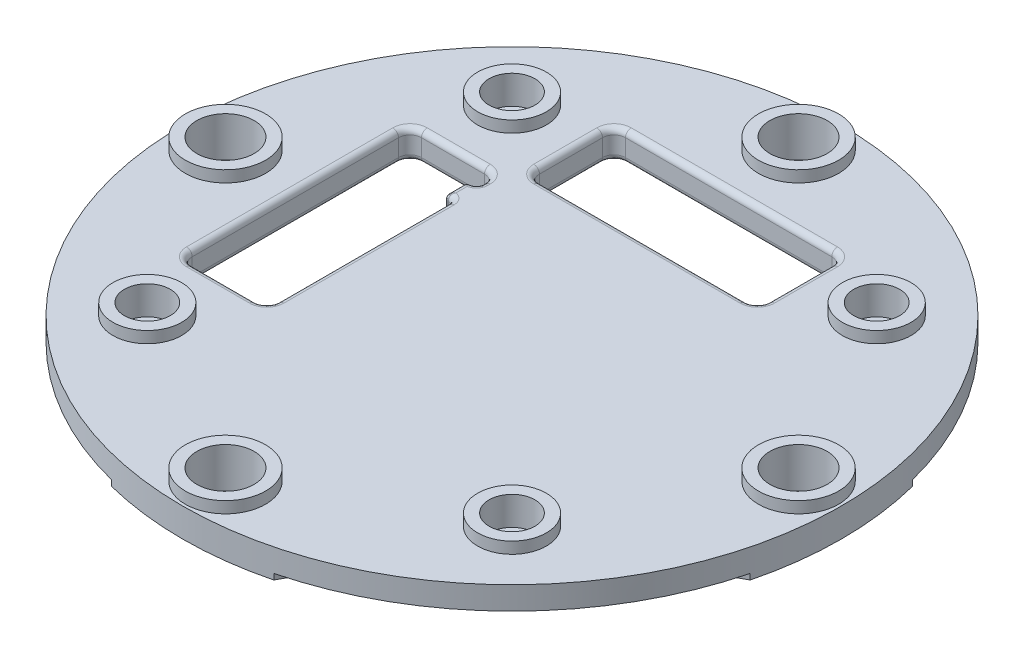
SolidWorks part; units mm, degrees
ref_plane "Front Plane" through (0, 0, 0) normal (0, 0, 1) x (1, 0, 0)
ref_plane "Top Plane" through (0, 0, 0) normal (0, 1, 0) x (1, 0, 0)
ref_plane "Right Plane" through (0, 0, 0) normal (1, 0, 0) x (0, 0, -1)
sketch "Sketch1" plane through (0, 0, 0) normal (0, 1, 0) x (1, 0, 0)
  circle A0 centre (0, 0) radius 57.5
  circle A1 centre (0, 0) radius 50 construction
  circle A2 centre (0, 50) radius 5
  circle A3 centre (50, 0) radius 5
  circle A4 centre (0, -50) radius 5
  circle A5 centre (-50, 0) radius 5
  point P15 (0, 0)
  dimension "D1" = 100
  dimension "D2" = 115
  dimension "D3" = 10
  dimension "D4" = 4
extrude "Boss-Extrude1" add sketch "Sketch1" along normal blind 5
sketch "Sketch11" plane through (0, 5, 0) normal (0, 1, 0) x (1, 0, 0)
  line L0 (0, 50) -> (0, 0) construction
  line L1 (0, 0) -> (-31.8198, 31.8198) construction
  circle A2 centre (0, 0) radius 45 construction
  circle A5 centre (-31.8198, 31.8198) radius 6
  circle A6 centre (31.8198, 31.8198) radius 6
  circle A7 centre (31.8198, -31.8198) radius 6
  circle A8 centre (-31.8198, -31.8198) radius 6
  point P16 (0, 0)
  dimension "D1" = 90
  dimension "D2" = 12
  dimension "D3" = 4
extrude "Boss-Extrude3" add sketch "Sketch11" along normal blind 2
sketch "Sketch12" plane through (0, 7, 0) normal (0, 1, 0) x (1, 0, 0)
  circle A0 centre (-31.8198, 31.8198) radius 4
  circle A1 centre (31.8198, 31.8198) radius 4
  circle A2 centre (31.8198, -31.8198) radius 4
  circle A3 centre (-31.8198, -31.8198) radius 4
  point P12 (0, 0)
  dimension "D1" = 8
  dimension "D2" = 4
extrude "Cut-Extrude9" cut sketch "Sketch12" against normal blind 5
sketch "Sketch13" plane through (0, 5, 0) normal (0, 1, 0) x (1, 0, 0)
  circle A0 centre (0, 50) radius 7
  circle A1 centre (0, 50) radius 5
  circle A2 centre (0, 50) radius 5 construction
  circle A3 centre (50, 0) radius 5
  circle A4 centre (50, 0) radius 7
  circle A5 centre (0, -50) radius 5
  circle A6 centre (0, -50) radius 7
  circle A7 centre (-50, 0) radius 5
  circle A8 centre (-50, 0) radius 7
  point P18 (0, 0)
  dimension "D1" = 2
  dimension "D2" = 4
extrude "Boss-Extrude4" add sketch "Sketch13" along normal blind 2
sketch "Sketch18" plane through (0, 0, 0) normal (0, -1, 0) x (-1, 0, 0)
  line L0 (0, 0) -> (-56.3135, -56.3135) construction
  circle A0 centre (-102.5305, -102.5305) radius 100
  circle A1 centre (-102.5305, 102.5305) radius 100
  circle A2 centre (102.5305, 102.5305) radius 100
  circle A3 centre (102.5305, -102.5305) radius 100
  point P15 (0, 0)
  dimension "D1" = 200
  dimension "D2" = 145
  dimension "D3" = 4
extrude "Cut-Extrude13" cut sketch "Sketch18" against normal blind 1
sketch "Sketch19" plane through (0, 0, 0) normal (0, -1, 0) x (-1, 0, 0)
  line L0 (-7.2, -4) -> (-7.2, 19.1)
  line L1 (19, -3.8) -> (-7, -3.8)
  line L2 (19, -3.8) -> (19, 18.9)
  line L3 (19, 18.9) -> (-7, 18.9)
  line L4 (-7, -3.8) -> (-7, 18.9)
  line L5 (23.25, 13.9) -> (-10.7424, 13.9)
  line L6 (23.25, 13.9) -> (23.25, 15.4)
  line L7 (23.25, 15.4) -> (-10.7424, 15.4)
  line L8 (-10.7424, 13.9) -> (-10.7424, 15.4)
  line L9 (19.2, 19.1) -> (-7.2, 19.1)
  line L10 (19.2, -4) -> (19.2, 19.1)
  line L11 (19.2, -4) -> (-7.2, -4)
  line L12 (23.45, 13.7) -> (23.45, 15.6)
  line L13 (23.45, 15.6) -> (-10.9424, 15.6)
  line L14 (-10.9424, 13.7) -> (-10.9424, 15.6)
  line L15 (23.45, 13.7) -> (-10.9424, 13.7)
  line L16 (-4, 7.2) -> (19.1, 7.2)
  line L17 (13.7, -23.45) -> (13.7, 10.9424)
  line L18 (15.6, -23.45) -> (15.6, 10.9424)
  line L19 (13.7, 10.9424) -> (15.6, 10.9424)
  line L20 (13.7, -23.45) -> (15.6, -23.45)
  line L21 (-4, -19.2) -> (19.1, -19.2)
  line L22 (19.1, -19.2) -> (19.1, 7.2)
  line L23 (-4, -19.2) -> (-4, 7.2)
  line L24 (0, 0) -> (-7.2, -4) construction
  line L25 (0, 0) -> (-4, 7.2) construction
  dimension "D1" = 19
  dimension "D2" = 7
  dimension "D3" = 22.7
  dimension "D4" = 18.9
  dimension "D5" = 3.5
  dimension "D6" = 1.5
  dimension "D7" = 4.25
  dimension "D8" = 3.7424
  dimension "D12" = 90
  dimension "D9" = 0.2
  dimension "D10" = 0.2
  dimension "D11" = 2
extrude "Cut-Extrude14" cut sketch "Sketch19" against normal blind 2 contours L10 L9 L0 L11 | L12 L13 L14 L15
sketch "Sketch20" plane through (0, 0, -19.1) normal (0, 0, 1) x (1, 0, 0)
  line L1 (7.2, 2) -> (-7.2, 2) construction
  line L2 (7.2, 2) -> (7.2, -12.4) construction
  line L3 (7.2, -12.4) -> (-7.2, -12.4) construction
  line L4 (-7.2, 2) -> (-7.2, -12.4) construction
  circle A0 centre (0, -5.2) radius 7.2
  dimension "D3" = 14.4
  dimension "D1" = 14.4
  dimension "D2" = 14.4
  dimension "D4" = 7.2
  dimension "D5" = 7.2
extrude "Cut-Extrude15" cut sketch "Sketch20" against normal blind 4.1
sketch "Sketch21" plane through (0, 0, 0) normal (0, -1, 0) x (-1, 0, 0)
  line L1 (20, 22.8) -> (-20, 22.8)
  line L2 (20, 22.8) -> (20, 37.8)
  line L3 (20, 37.8) -> (-20, 37.8)
  line L4 (-20, 22.8) -> (-20, 37.8)
  line L5 (20, 22.8) -> (-20, 37.8) construction
  line L6 (20, 37.8) -> (-20, 22.8) construction
  line L7 (-7.2, -4) -> (-7.2, 13.7) construction
  point P0 (0, 30.3)
  point P5 (0, 0)
  point P8 (0, 0)
  dimension "D1" = 15
  dimension "D2" = 22.8
  dimension "D3" = 7.2
  dimension "D4" = 40
extrude "Cut-Extrude16" cut sketch "Sketch21" against normal blind 14.1
fillet "Fillet3" radius 2 4 edges at (20, 2.5, -37.8) (20, 2.5, -22.8) (-20, 2.5, -37.8) (-20, 2.5, -22.8)
fillet "Fillet4" radius 1 17 edges at (19.4142, 5, -37.2142) (20, 5, -30.3) (19.4142, 5, -23.3858) (0, 5, -22.8) (-19.4142, 5, -23.3858) (-20, 5, -30.3) (-19.4142, 5, -37.2142) (-11.49, 0, -22.8) (-19.4142, 0, -23.3858) (11.49, 0, -22.8) (19.4142, 0, -23.3858) (20, 0, -30.3) (19.4142, 0, -37.2142) (0, 0, -37.8) (-19.4142, 0, -37.2142) (0, 5, -37.8) (-20, 0, -30.3)
sketch "Sketch24" plane through (0, 0, 0) normal (0, -1, 0) x (-1, 0, 0)
  line L0 (-4, -19.2) -> (-4, 7.2)
  line L1 (-3.8, -19) -> (18.9, -19)
  line L2 (-3.8, -19) -> (-3.8, 7)
  line L3 (-3.8, 7) -> (18.9, 7)
  line L4 (18.9, -19) -> (18.9, 7)
  line L5 (13.9, 11.25) -> (15.4, 11.25)
  line L6 (13.9, 11.25) -> (13.9, -23.25)
  line L7 (13.9, -23.25) -> (15.4, -23.25)
  line L8 (15.4, 11.25) -> (15.4, -23.25)
  line L9 (-4, 7.2) -> (19.1, 7.2)
  line L10 (19.1, -19.2) -> (19.1, 7.2)
  line L11 (-4, -19.2) -> (19.1, -19.2)
  line L12 (13.7, 11.45) -> (13.7, -23.45)
  line L13 (13.7, -23.45) -> (15.6, -23.45)
  line L14 (15.6, 11.45) -> (15.6, -23.45)
  line L15 (13.7, 11.45) -> (15.6, 11.45)
  line L17 (-7.2, -4) -> (19.2, -4)
  line L18 (-7.2, -4) -> (-7.2, 13.7)
  line L19 (-7.2, 13.7) -> (19.2, 13.7)
  line L20 (19.2, -4) -> (19.2, 13.7)
  point P9 (14.65, -23.25)
  dimension "D1" = 19
  dimension "D2" = 7
  dimension "D3" = 22.7
  dimension "D4" = 18.9
  dimension "D5" = 1.5
  dimension "D6" = 3.5
  dimension "D7" = 4.25
  dimension "D8" = 4.25
  dimension "D9" = 0.2
  dimension "D10" = 0.2
extrude "Boss-Extrude5" add sketch "Sketch24" along normal blind 12.1 contours L12 L2 L1 M14 | L12 L1 L2 L0 L11 M14 | L1 L14 L11 L10 L4 M14 | L14 L1 L4 M14 | L14 L8 L1 M14 | L8 L6 L1 M14 | L12 L1 L6 M14 | L11 L6 L7 L8 | L14 L11 L8 L7 L6 L12 L13 | L6 L11 L8 L1 | L1 L12 L11 L6 | L14 L1 L8 L11
sketch "Sketch25" plane through (0, -12.1, 0) normal (0, -1, 0) x (-1, 0, 0)
  line L0 (-4, -19.2) -> (13.7, -19.2) construction
  line L1 (17.1, -17.2) -> (-2, -17.2)
  line L2 (17.1, -17.2) -> (17.1, -6)
  line L3 (17.1, -6) -> (-2, -6)
  line L4 (-2, -17.2) -> (-2, -6)
  line L5 (19.1, -19.2) -> (19.1, -4) construction
  line L6 (-4, -19.2) -> (-4, -4) construction
  line L7 (19.1, -4) -> (-4, -4) construction
  dimension "D1" = 2
  dimension "D2" = 2
  dimension "D3" = 2
  dimension "D4" = 2
extrude "Cut-Extrude17" cut sketch "Sketch25" against normal blind 12.1
sketch "Sketch26" plane through (-19.1, 0, 0) normal (-1, 0, 0) x (0, 0, 1)
  line L0 (4, -12.1) -> (4, 0) construction
  line L1 (4, -9.6) -> (19.2, -9.6)
  line L2 (4, -9.6) -> (4, -14.6)
  line L3 (4, -14.6) -> (19.2, -14.6)
  line L4 (19.2, -9.6) -> (19.2, -14.6)
  line L5 (19.2, -12.1) -> (19.2, 0) construction
  line L6 (19.2, -12.1) -> (4, -12.1) construction
  dimension "D1" = 0
  dimension "D2" = 5
  dimension "D3" = 2.5
extrude "Boss-Extrude6" add sketch "Sketch26" along normal blind 2
fillet "Fillet5" radius 10 1 edges at (-19.1, -9.6, 11.6)
sketch "Sketch27" plane through (4, 0, 0) normal (1, 0, 0) x (0, 0, -1)
  line L0 (-19.2, -12.1) -> (-19.2, 0) construction
  line L1 (-19.2, -9.6) -> (-4, -9.6)
  line L2 (-19.2, -9.6) -> (-19.2, -14.6)
  line L3 (-19.2, -14.6) -> (-4, -14.6)
  line L4 (-4, -9.6) -> (-4, -14.6)
  dimension "D1" = 5
extrude "Boss-Extrude7" add sketch "Sketch27" along normal blind 2
fillet "Fillet6" radius 10 1 edges at (4, -9.6, 11.6)
sketch "Sketch28" plane through (-13.7, 0, 0) normal (1, 0, 0) x (0, 0, -1)
  line L0 (-23.45, -12.1) -> (-23.45, 0) construction
  line L1 (-23.45, -9.6) -> (-19.2, -9.6)
  line L2 (-23.45, -9.6) -> (-23.45, -14.6)
  line L3 (-23.45, -14.6) -> (-19.2, -14.6)
  line L4 (-19.2, -9.6) -> (-19.2, -14.6)
  dimension "D1" = 5
extrude "Boss-Extrude8" add sketch "Sketch28" along normal blind 2
sketch "Sketch29" plane through (-15.6, 0, 0) normal (-1, 0, 0) x (0, 0, 1)
  line L1 (19.2, -14.6) -> (23.45, -14.6)
  line L2 (19.2, -14.6) -> (19.2, -9.6)
  line L3 (19.2, -9.6) -> (23.45, -9.6)
  line L4 (23.45, -14.6) -> (23.45, -9.6)
extrude "Boss-Extrude9" add sketch "Sketch29" along normal blind 2
fillet "Fillet7" radius 10 2 edges at (-13.7, -9.6, 21.325) (-15.6, -9.6, 21.325)
sketch "Sketch30" plane through (0, 0, 0) normal (0, -1, 0) x (-1, 0, 0)
  line L0 (19.1, -19.2) -> (19.1, -4) construction
  line L1 (22.8, -20) -> (37.8, -20)
  line L2 (22.8, -20) -> (22.8, 20)
  line L3 (22.8, 20) -> (37.8, 20)
  line L4 (37.8, -20) -> (37.8, 20)
  line L6 (23.45, 13.7) -> (19.2, 13.7) construction
  line L7 (22.8, 12.7) -> (24.45, 12.7)
  line L8 (22.8, 12.7) -> (22.8, 16.6)
  line L9 (22.8, 16.6) -> (24.45, 16.6)
  line L10 (24.45, 12.7) -> (24.45, 16.6)
  line L11 (23.45, 13.7) -> (23.45, 15.6) construction
  line L12 (23.45, 15.6) -> (19.2, 15.6) construction
  point P15 (24.45, 14.65)
  dimension "D1" = 15
  dimension "D2" = 40
  dimension "D3" = 3.7
  dimension "D4" = 20
  dimension "D5" = 1
  dimension "D6" = 1
  dimension "D7" = 1
extrude "Cut-Extrude18" cut sketch "Sketch30" against normal blind 22 contours L10 L7 L2 L1 L4 L3 L9
fillet "Fillet8" radius 2 4 edges at (-22.8, 2.5, -20) (-37.8, 2.5, -20) (-37.8, 2.5, 20) (-22.8, 2.5, 20)
fillet "Fillet9" radius 1 2 edges at (-22.8, 2.5, -12.7) (-22.8, 2.5, -16.6)
fillet "Fillet10" radius 0.5 2 edges at (-24.45, 2.5, -16.6) (-24.45, 2.5, -12.7)
fillet "Fillet11" radius 1 28 edges at (-23.0929, 5, -16.8929) (-24.3036, 5, -16.4536) (-24.3036, 5, -12.8464) (-23.0929, 5, -12.4071) (-23.0929, 0, -12.4071) (-24.3036, 0, -12.8464) (-24.3036, 0, -16.4536) (-23.0929, 0, -16.8929) (-30.3, 5, -20) (-37.2142, 5, -19.4142) (-37.8, 5, 0) (-37.2142, 5, 19.4142) (-30.3, 5, 20) (-23.3858, 5, 19.4142) (-22.8, 5, 3.15) (-24.45, 5, -14.65) (-22.8, 5, -17.8) (-23.3858, 0, 19.4142) (-30.3, 0, 20) (-37.2142, 0, 19.4142) (-37.8, 0, 0) (-37.2142, 0, -19.4142) (-30.3, 0, -20) (-22.8, 0, -17.8) (-24.45, 0, -14.65) (-23.3858, 0, -19.4142) (-23.3858, 5, -19.4142) (-22.8, 0, 3.15)
